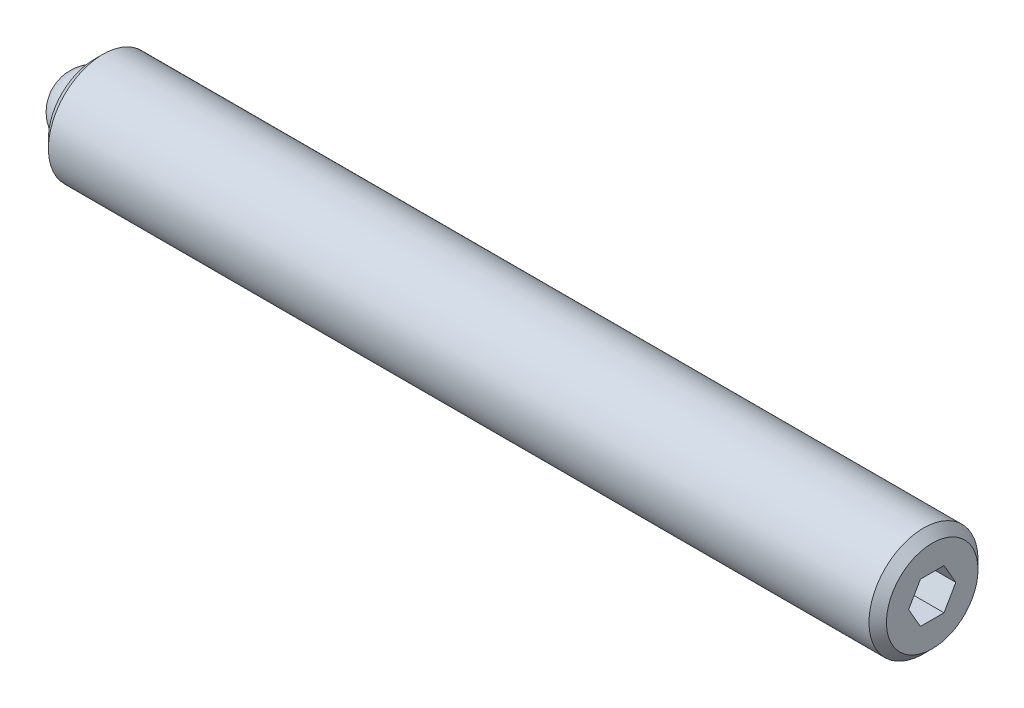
SolidWorks part; units mm, degrees
ref_plane "Front Plane" through (0, 0, 0) normal (0, 0, 1) x (1, 0, 0)
ref_plane "Top Plane" through (0, 0, 0) normal (0, 1, 0) x (1, 0, 0)
ref_plane "Right Plane" through (0, 0, 0) normal (1, 0, 0) x (0, 0, -1)
sketch "Sketch2" plane through (0, 0, 0) normal (1, 0, 0) x (0, 0, -1)
  circle A0 centre (0, 0) radius 3.175
  dimension "D1" = 6.35
extrude "Boss-Extrude1" add sketch "Sketch2" along normal blind 48.8156
sketch "Sketch3" plane through (0, 0, 0) normal (-1, 0, 0) x (0, 0, 1)
  circle A0 centre (0, 0) radius 1.9812
  dimension "D1" = 3.9624
chamfer "Chamfer1" distance 0.508 angle 45 1 edges at (0, 0, -3.175)
chamfer "Chamfer2" distance 0.508 angle 45 1 edges at (48.8156, 0, -3.175)
sketch "Sketch4" plane through (48.8156, 0, 0) normal (1, 0, 0) x (0, 0, -1)
  line L1 (1.3748, 0) -> (0.6874, 1.1906)
  line L2 (0.6874, 1.1906) -> (-0.6874, 1.1906)
  line L3 (-0.6874, 1.1906) -> (-1.3748, 0)
  line L4 (-1.3748, 0) -> (-0.6874, -1.1906)
  line L5 (-0.6874, -1.1906) -> (0.6874, -1.1906)
  line L6 (0.6874, -1.1906) -> (1.3748, 0)
  circle A0 centre (0, 0) radius 1.1906 construction
  dimension "D1" = 2.3813
extrude "Cut-Extrude2" cut sketch "Sketch4" against normal blind 2.286
extrude "Cut-Extrude3" cut sketch "Sketch3" against normal blind 1.9844
sketch "Sketch5" plane through (0, 0, 0) normal (-1, 0, 0) x (0, 0, 1)
  line L0 (0, 0) -> (0, -1.9844)
  line L1 (0, 0) -> (0, 1.9844)
  arc A0 (0, 1.9844) -> (0, -1.9844) centre (0, 0) ccw
  dimension "D1" = 1.9844
revolve "Revolve1" add sketch "Sketch5" angle 360 about L1
